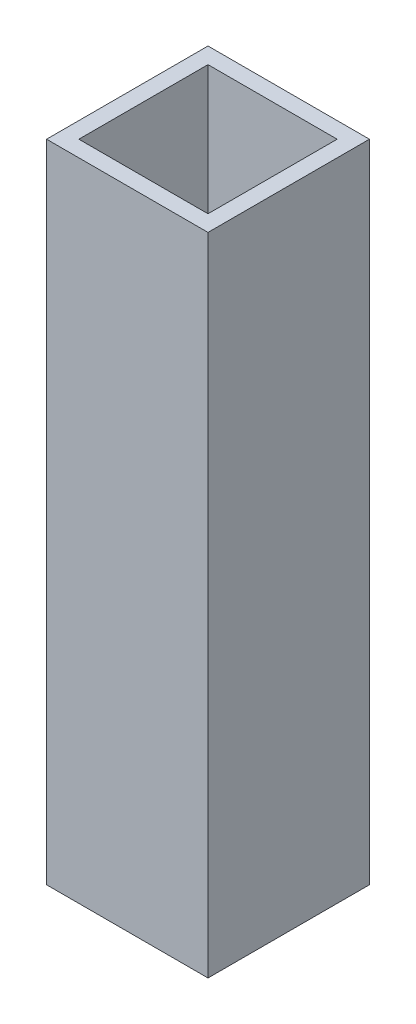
SolidWorks part; units mm, degrees
ref_plane "前视基准面" through (0, 0, 0) normal (0, 0, 1) x (1, 0, 0)
ref_plane "上视基准面" through (0, 0, 0) normal (0, 1, 0) x (1, 0, 0)
ref_plane "右视基准面" through (0, 0, 0) normal (1, 0, 0) x (0, 0, -1)
other "Configuration Table"
sketch "草图1" plane through (0, 0, 0) normal (0, 1, 0) x (1, 0, 0)
  line L0 (-8, 8) -> (-8, -8)
  line L1 (-10, 10) -> (10, 10)
  line L2 (-10, 10) -> (-10, -10)
  line L3 (-10, -10) -> (10, -10)
  line L4 (10, 10) -> (10, -10)
  line L5 (-10, 10) -> (10, -10) construction
  line L6 (-10, -10) -> (10, 10) construction
  line L7 (-8, -8) -> (8, -8)
  line L8 (8, 8) -> (8, -8)
  line L9 (-8, 8) -> (8, 8)
  point P0 (0, 0)
  dimension "D1" = 20
  dimension "D2" = 20
  dimension "D3" = 2
extrude "凸台-拉伸1" add sketch "草图1" along normal blind 80
